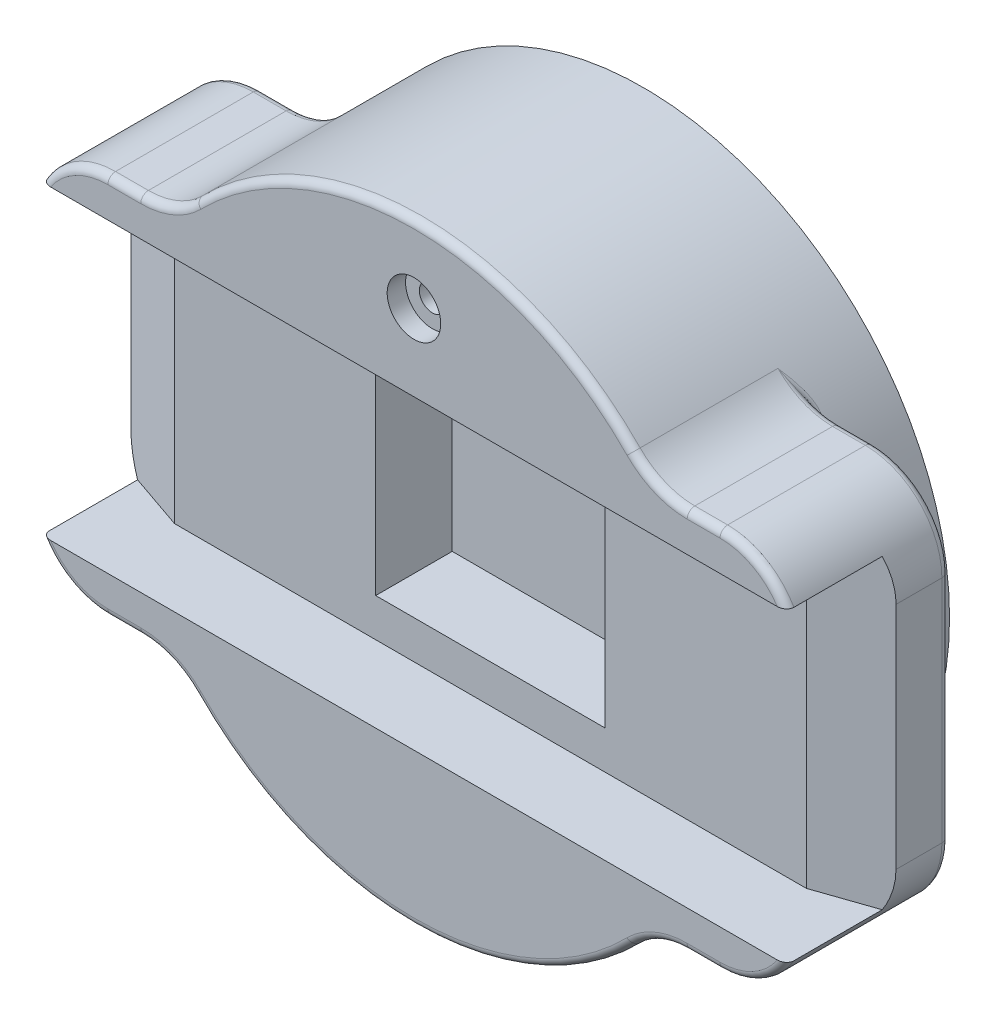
SolidWorks part; units mm, degrees
ref_plane "Płaszczyzna przednia" through (0, 0, 0) normal (0, 0, 1) x (1, 0, 0)
ref_plane "Płaszczyzna górna" through (0, 0, 0) normal (0, 1, 0) x (1, 0, 0)
ref_plane "Płaszczyzna prawa" through (0, 0, 0) normal (1, 0, 0) x (0, 0, -1)
sketch "Szkic1" plane through (0, 0, 0) normal (0, 0, 1) x (1, 0, 0)
  circle A0 centre (0, 0) radius 40
extrude "Dodanie-wyciągnięcie1" add sketch "Szkic1" along normal blind 20
sketch "Szkic2" plane through (0, 0, 0) normal (0, 0, -1) x (-1, 0, 0)
  line L1 (-15, 15) -> (15, 15)
  line L2 (-15, 15) -> (-15, -15)
  line L3 (-15, -15) -> (15, -15)
  line L4 (15, 15) -> (15, -15)
  line L5 (-15, 15) -> (15, -15) construction
  line L6 (-15, -15) -> (15, 15) construction
  point P0 (0, 0)
  dimension "D1" = 30
  dimension "D2" = 30
extrude "Dodanie-wyciągnięcie2" add sketch "Szkic2" along normal blind 10
sketch "Szkic4" plane through (0, 0, 20) normal (0, 0, 1) x (1, 0, 0)
  line L1 (-50, 25) -> (50, 25)
  line L2 (-50, 25) -> (-50, -25)
  line L3 (-50, -25) -> (50, -25)
  line L4 (50, 25) -> (50, -25)
  line L5 (-50, 25) -> (50, -25) construction
  line L6 (-50, -25) -> (50, 25) construction
  point P0 (0, 0)
  dimension "D1" = 100
  dimension "D2" = 50
extrude "Dodanie-wyciągnięcie4" add sketch "Szkic4" against normal blind 10
sketch "Szkic5" plane through (0, 0, 20) normal (0, 0, 1) x (1, 0, 0)
  line L0 (50, -25) -> (50, 25) construction
  line L1 (-50, 25) -> (-31.225, 25)
  line L2 (-50, 25) -> (-50, 20)
  line L3 (-50, 20) -> (50, 20)
  line L4 (50, 25) -> (50, 20)
  line L5 (31.225, -25) -> (50, -25)
  line L7 (31.225, 25) -> (50, 25)
  line L8 (-50, -25) -> (-31.225, -25)
  line L9 (-50, -25) -> (-50, -20)
  line L10 (-50, -20) -> (50, -20)
  line L11 (50, -25) -> (50, -20)
  arc A1 (-31.225, -25) -> (31.225, -25) centre (0, 0) ccw
  arc A3 (31.225, 25) -> (-31.225, 25) centre (0, 0) ccw
  point P4 (0, 22.5)
  point P15 (0, -22.5)
  dimension "D1" = 5
  dimension "D2" = 5
extrude "Dodanie-wyciągnięcie5" add sketch "Szkic5" along normal blind 10
fillet "Zaokrąglenie1" radius 10 4 edges at (31.225, -25, 20) (-31.225, -25, 20) (-31.225, 25, 20) (31.225, 25, 20)
fillet "Zaokrąglenie2" radius 10 4 edges at (-50, 25, 20) (-50, -25, 20) (50, -25, 20) (50, 25, 20)
fillet "Zaokrąglenie3" radius 1 16 edges at (-47.0711, -22.0711, 10) (-37.8536, -25, 10) (-31.8342, -25.7805, 10) (-40, 0, 10) (-31.8342, 25.7805, 10) (-37.8536, 25, 10) (-47.0711, 22.0711, 10) (-50, 0, 10) (47.0711, 22.0711, 10) (37.8536, 25, 10) (31.8342, 25.7805, 10) (40, 0, 10) (31.8342, -25.7805, 10) (37.8536, -25, 10) (47.0711, -22.0711, 10) (50, 0, 10)
fillet "Zaokrąglenie4" radius 1 14 edges at (-45, -23.6603, 30) (-37.8536, -25, 30) (-31.8342, -25.7805, 30) (45, -23.6603, 30) (37.8536, -25, 30) (31.8342, -25.7805, 30) (45, 23.6603, 30) (37.8536, 25, 30) (31.8342, 25.7805, 30) (-45, 23.6603, 30) (-37.8536, 25, 30) (-31.8342, 25.7805, 30) (0, -40, 30) (0, 40, 30)
sketch "Szkic6" plane through (0, 0, 20) normal (0, 0, 1) x (1, 0, 0)
  line L1 (-15, 15) -> (15, 15)
  line L2 (-15, 15) -> (-15, -15)
  line L3 (-15, -15) -> (15, -15)
  line L4 (15, 15) -> (15, -15)
  line L5 (-15, 15) -> (15, -15) construction
  line L6 (-15, -15) -> (15, 15) construction
  point P0 (0, 0)
  dimension "D1" = 30
  dimension "D2" = 30
extrude "Wytnij-wyciągnięcie1" cut sketch "Szkic6" against normal blind 10
sketch "Szkic7" plane through (0, 0, 30) normal (0, 0, 1) x (1, 0, 0)
  line L0 (47.4833, -20) -> (-47.4833, -20) construction
  point P0 (0, 30)
  dimension "D1" = 50
hole_wizard "Pogłębienie walcowe pod M3 Śrubę z łbem stożkowym ściętym1" positions "Szkic 3D1" profile "Szkic8" counterbore size "M3" standard "ISO"
sketch3d "Szkic 3D1"
  point P0 (0, 30, 30)
sketch "Szkic8" plane through (0, 30, 30) normal (1, 0, 0) x (0, -1, 0)
  line L0 (0, 0) -> (0, 30)
  line L1 (0, 30) -> (1.7, 30)
  line L3 (1.7, 30) -> (1.7, 2.4)
  line L4 (1.7, 2.4) -> (3.5, 2.4)
  line L5 (3.5, 2.4) -> (3.5, 0)
  line L7 (3.5, 0) -> (0, 0)
  line L11 (0, -6.35) -> (0, 107.95) construction
  dimension "Średnica otworu na wylot" = 3.4
  dimension "Głębokość otworu na wylot" = 30
  dimension "Średnica pogłębienia walcowego" = 7
  dimension "Głębokość pogłębienia walcowego" = 2.4
chamfer "Sfazowanie1" distance 3 angle 71 2 edges
